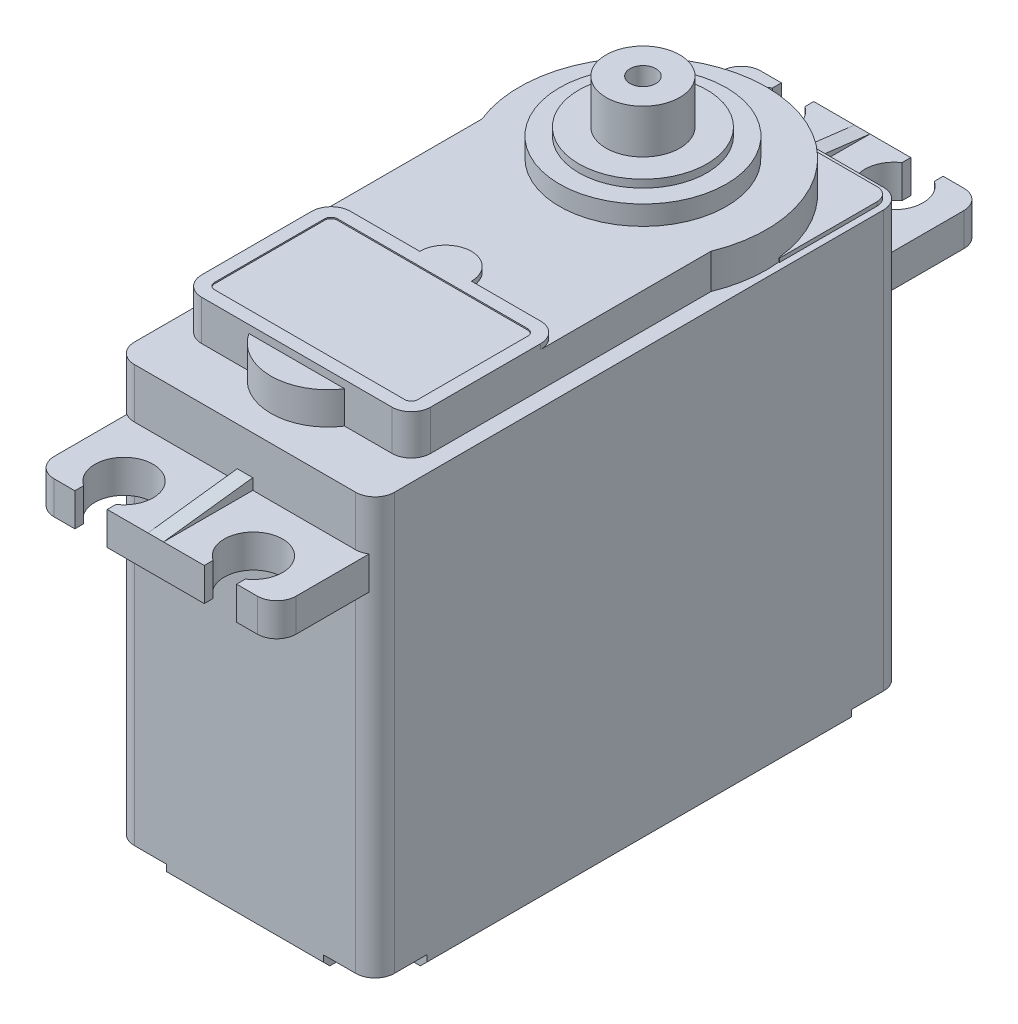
SolidWorks part; units mm, degrees
ref_plane "Front Plane" through (0, 0, 0) normal (0, 0, 1) x (1, 0, 0)
ref_plane "Top Plane" through (0, 0, 0) normal (0, 1, 0) x (1, 0, 0)
ref_plane "Right Plane" through (0, 0, 0) normal (1, 0, 0) x (0, 0, -1)
sketch "Sketch1" plane through (0, 0, 0) normal (0, 1, 0) x (1, 0, 0)
  line L0 (-10.05, -5.18) -> (10.05, -5.18) construction
  line L1 (-8.55, -25.58) -> (8.55, -25.58)
  line L2 (-10.05, -24.08) -> (-10.05, 13.72)
  line L3 (-8.55, 15.22) -> (8.55, 15.22)
  line L4 (10.05, -24.08) -> (10.05, 13.72)
  line L5 (-10.05, -25.58) -> (10.05, 15.22) construction
  line L6 (-10.05, 15.22) -> (10.05, -25.58) construction
  line L7 (0, -5.18) -> (0, 15.22) construction
  arc A0 (-10.05, 13.72) -> (-8.55, 15.22) centre (-8.55, 13.72) cw
  arc A1 (8.55, 15.22) -> (10.05, 13.72) centre (8.55, 13.72) cw
  arc A2 (10.05, -24.08) -> (8.55, -25.58) centre (8.55, -24.08) cw
  arc A3 (-8.55, -25.58) -> (-10.05, -24.08) centre (-8.55, -24.08) cw
  point P0 (0, 0)
  dimension "D5" = 1.5
  dimension "D1" = 20.1
  dimension "D2" = 40.8
  dimension "D3" = 25.58
extrude "Boss-Extrude1" add sketch "Sketch1" along normal blind 33.2
ref_plane "Plane1" through (0, 26.8, 0) normal (0, 1, 0) x (1, 0, 0)
sketch "Sketch4" plane through (0, 26.8, 0) normal (0, 1, 0) x (1, 0, 0)
  line L0 (-6.25, 22.12) -> (-6.25, 21.4408)
  line L1 (-7.85, -32.48) -> (-6.25, -32.48)
  line L2 (-9.35, -30.98) -> (-9.35, 20.62)
  line L3 (-7.85, 22.12) -> (-6.25, 22.12)
  line L4 (9.35, -30.98) -> (9.35, 20.62)
  line L5 (-9.35, -32.48) -> (9.35, 22.12) construction
  line L6 (-9.35, 22.12) -> (9.35, -32.48) construction
  line L7 (-3.75, 22.12) -> (-3.75, 21.4408)
  line L8 (-3.75, 22.12) -> (3.75, 22.12)
  line L9 (-10.05, -5.18) -> (10.05, -5.18) construction
  line L10 (6.25, 22.12) -> (7.85, 22.12)
  line L11 (6.25, -32.48) -> (6.25, -31.8008)
  line L12 (3.75, -32.48) -> (3.75, -31.8008)
  line L13 (0, -25.58) -> (0, 15.22) construction
  line L14 (-8.55, -25.58) -> (8.55, -25.58) construction
  line L15 (8.55, 15.22) -> (-8.55, 15.22) construction
  line L16 (-3.75, -32.48) -> (3.75, -32.48)
  line L17 (3.75, 22.12) -> (3.75, 21.4408)
  line L18 (6.25, 22.12) -> (6.25, 21.4408)
  line L19 (-3.75, -32.48) -> (-3.75, -31.8008)
  line L20 (-6.25, -32.48) -> (-6.25, -31.8008)
  line L21 (6.25, -32.48) -> (7.85, -32.48)
  line L22 (-10.05, 13.72) -> (-10.05, -24.08) construction
  arc A0 (7.85, 22.12) -> (9.35, 20.62) centre (7.85, 20.62) cw
  arc A1 (9.35, -30.98) -> (7.85, -32.48) centre (7.85, -30.98) cw
  arc A2 (-7.85, -32.48) -> (-9.35, -30.98) centre (-7.85, -30.98) cw
  arc A3 (-9.35, 20.62) -> (-7.85, 22.12) centre (-7.85, 20.62) cw
  arc A4 (-6.25, 21.4408) -> (-3.75, 21.4408) centre (-5, 19.57) ccw
  arc A5 (6.25, -31.8008) -> (3.75, -31.8008) centre (5, -29.93) ccw
  arc A6 (6.25, 21.4408) -> (3.75, 21.4408) centre (5, 19.57) cw
  arc A7 (-6.25, -31.8008) -> (-3.75, -31.8008) centre (-5, -29.93) cw
  point P0 (0, -5.18)
  dimension "D3" = 1.5
  dimension "D4" = 2.5
  dimension "D5" = 2.25
  dimension "D1" = 18.7
  dimension "D6" = 0.6792
  dimension "D7" = 10
  dimension "D8" = 49.5
extrude "Boss-Extrude2" add sketch "Sketch4" along normal blind 2.55
sketch "Sketch16" plane through (0, 33.2, 0) normal (0, 1, 0) x (1, 0, 0)
  line L0 (-9.55, 6.17) -> (9.55, 6.17)
  line L1 (0, 14.72) -> (0, -2.38) construction
  line L8 (-9.55, 13.72) -> (-9.55, -24.08)
  line L9 (-8.55, -25.08) -> (8.55, -25.08)
  line L10 (9.55, -24.08) -> (9.55, 13.72)
  line L11 (8.55, 14.72) -> (-8.55, 14.72)
  line L12 (-9.55, 13.72) -> (-9.55, -24.08)
  line L13 (-8.55, -25.08) -> (8.55, -25.08)
  line L14 (9.55, -24.08) -> (9.55, 13.72)
  line L15 (8.55, 14.72) -> (-8.55, 14.72)
  arc A8 (-8.55, 14.72) -> (-9.55, 13.72) centre (-8.55, 13.72) ccw
  arc A9 (-9.55, -24.08) -> (-8.55, -25.08) centre (-8.55, -24.08) ccw
  arc A10 (8.55, -25.08) -> (9.55, -24.08) centre (8.55, -24.08) ccw
  arc A11 (9.55, 13.72) -> (8.55, 14.72) centre (8.55, 13.72) ccw
  arc A12 (-8.55, 14.72) -> (-9.55, 13.72) centre (-8.55, 13.72) ccw
  arc A13 (-9.55, -24.08) -> (-8.55, -25.08) centre (-8.55, -24.08) ccw
  arc A14 (8.55, -25.08) -> (9.55, -24.08) centre (8.55, -24.08) ccw
  arc A15 (9.55, 13.72) -> (8.55, 14.72) centre (8.55, 13.72) ccw
  point P4 (0, 6.17)
  dimension "D1" = 0.5
extrude "Boss-Extrude11" add sketch "Sketch16" along normal blind 0.3 contours L1 L15 A12 L12 L0 | L15 L1 L0 L14 A15
sketch "Sketch5" plane through (0, 33.2, 0) normal (0, 1, 0) x (1, 0, 0)
  line L0 (8.55, -25.58) -> (-8.55, -25.58) construction
  line L1 (9.55, 6.17) -> (9.55, 13.72) construction
  line L2 (-8.85, 1.5811) -> (-8.85, -20.08)
  line L3 (-7.35, -21.58) -> (7.35, -21.58)
  line L4 (8.85, 1.5811) -> (8.85, -20.08)
  line L5 (-9.55, 13.72) -> (-9.55, 6.17) construction
  line L6 (0, 5.17) -> (0, -21.58) construction
  line L7 (8.55, 14.72) -> (-8.55, 14.72) construction
  arc A0 (8.85, 1.5811) -> (-8.85, 1.5811) centre (0, 5.17) ccw
  arc A1 (8.85, -20.08) -> (7.35, -21.58) centre (7.35, -20.08) cw
  arc A2 (-7.35, -21.58) -> (-8.85, -20.08) centre (-7.35, -20.08) cw
  dimension "D2" = 1.5
  dimension "D3" = 17.7
  dimension "D6" = 4
extrude "Boss-Extrude3" add sketch "Sketch5" along normal blind 2.7
sketch "Sketch6" plane through (0, 33.2, 0) normal (0, 1, 0) x (1, 0, 0)
  circle A0 centre (0, -19.1575) radius 4.4225
extrude "Boss-Extrude4" add sketch "Sketch6" along normal blind 2.5
sketch "Sketch7" plane through (0, 35.9, 0) normal (0, 1, 0) x (1, 0, 0)
  circle A0 centre (0, 5.17) radius 6.45
  arc A1 (8.85, 1.5811) -> (-8.85, 1.5811) centre (0, 5.17) ccw construction
  dimension "D1" = 12.9
extrude "Boss-Extrude5" add sketch "Sketch7" along normal blind 1.5
sketch "Sketch8" plane through (0, 37.4, 0) normal (0, 1, 0) x (1, 0, 0)
  circle A2 centre (0, 5.17) radius 4.95
  circle A3 centre (0, 5.17) radius 4.95
  dimension "D1" = 1.5
extrude "Boss-Extrude6" add sketch "Sketch8" along normal blind 0.6
sketch "Sketch10" plane through (0, 38, 0) normal (0, 1, 0) x (1, 0, 0)
  circle A1 centre (0, 5.17) radius 2.85
  dimension "D1" = 5.7
extrude "Boss-Extrude7" add sketch "Sketch10" along normal blind 3.4
sketch "Sketch12" plane through (0, 41.4, 0) normal (0, 1, 0) x (1, 0, 0)
  circle A0 centre (0, 5.17) radius 1
  dimension "D1" = 2
extrude "Cut-Extrude1" cut sketch "Sketch12" against normal blind 5
sketch "Sketch13" plane through (0, 35.9, 0) normal (0, 1, 0) x (1, 0, 0)
  line L0 (-8.85, 1.5811) -> (-8.85, -20.08) construction
  line L1 (-7.35, -21.58) -> (7.35, -21.58) construction
  line L2 (8.85, -20.08) -> (8.85, 1.5811) construction
  line L3 (-8.85, -11.58) -> (-8.85, -20.08)
  line L4 (-7.35, -21.58) -> (7.35, -21.58)
  line L5 (8.85, -20.08) -> (8.85, -11.58)
  line L6 (-7.85, -11.58) -> (-7.85, -20.08)
  line L7 (-7.35, -20.58) -> (7.35, -20.58)
  line L8 (7.85, -20.08) -> (7.85, -11.58)
  line L9 (-7.35, -11.08) -> (7.35, -11.08)
  line L10 (-7.35, -10.08) -> (-2, -10.08)
  line L11 (2, -10.08) -> (7.35, -10.08)
  line L12 (0, -10.08) -> (0, -11.08) construction
  arc A0 (-8.85, -20.08) -> (-7.35, -21.58) centre (-7.35, -20.08) ccw construction
  arc A1 (7.35, -21.58) -> (8.85, -20.08) centre (7.35, -20.08) ccw construction
  arc A2 (-8.85, -20.08) -> (-7.35, -21.58) centre (-7.35, -20.08) ccw
  arc A3 (7.35, -21.58) -> (8.85, -20.08) centre (7.35, -20.08) ccw
  arc A4 (-7.85, -20.08) -> (-7.35, -20.58) centre (-7.35, -20.08) ccw
  arc A5 (7.35, -20.58) -> (7.85, -20.08) centre (7.35, -20.08) ccw
  arc A6 (7.35, -11.08) -> (7.85, -11.58) centre (7.35, -11.58) cw
  arc A7 (-7.35, -11.08) -> (-7.85, -11.58) centre (-7.35, -11.58) ccw
  arc A8 (7.35, -10.08) -> (8.85, -11.58) centre (7.35, -11.58) cw
  arc A9 (-7.35, -10.08) -> (-8.85, -11.58) centre (-7.35, -11.58) ccw
  arc A10 (2, -10.08) -> (-2, -10.08) centre (0, -10.08) ccw
  point P8 (-7.85, 0.3518)
  point P15 (7.85, 0.3518)
  point P27 (0, 0)
  point P30 (-0.1288, -9.0569)
  point P32 (-7.786, -11.601)
  dimension "D2" = 0.5
  dimension "D1" = 1
  dimension "D3" = 1.5
  dimension "D4" = 4
  dimension "D5" = 9.5
extrude "Boss-Extrude9" add sketch "Sketch13" along normal blind 0.4
sketch "Sketch14" plane through (0, 35.9, 0) normal (0, 1, 0) x (1, 0, 0)
  line L3 (-7.85, -11.58) -> (-7.85, -20.08)
  line L4 (-7.85, -11.58) -> (-7.85, -20.08)
  line L5 (-7.35, -20.58) -> (7.35, -20.58)
  line L6 (-7.35, -20.58) -> (7.35, -20.58)
  line L7 (7.85, -20.08) -> (7.85, -11.58)
  line L8 (7.85, -20.08) -> (7.85, -11.58)
  line L10 (7.35, -11.08) -> (-7.35, -11.08)
  line L11 (7.35, -11.08) -> (-7.35, -11.08)
  arc A3 (-7.85, -20.08) -> (-7.35, -20.58) centre (-7.35, -20.08) ccw
  arc A4 (-7.85, -20.08) -> (-7.35, -20.58) centre (-7.35, -20.08) ccw
  arc A5 (7.35, -20.58) -> (7.85, -20.08) centre (7.35, -20.08) ccw
  arc A6 (7.35, -20.58) -> (7.85, -20.08) centre (7.35, -20.08) ccw
  arc A7 (7.85, -11.58) -> (7.35, -11.08) centre (7.35, -11.58) ccw
  arc A8 (7.85, -11.58) -> (7.35, -11.08) centre (7.35, -11.58) ccw
  arc A10 (-7.35, -11.08) -> (-7.85, -11.58) centre (-7.35, -11.58) ccw
  arc A11 (-7.35, -11.08) -> (-7.85, -11.58) centre (-7.35, -11.58) ccw
  dimension "D1" = 0
extrude "Boss-Extrude10" add sketch "Sketch14" along normal blind 0.3
chamfer "Chamfer1" distance 0.5 angle 45 8 edges at (-10.05, 0, 5.18) (-9.6107, 0, 25.1407) (0, 0, 25.58) (9.6107, 0, 25.1407) (10.05, 0, 5.18) (9.6107, 0, -14.7807) (0, 0, -15.22) (-9.6107, 0, -14.7807)
sketch "Sketch17" plane through (0, 0, 0) normal (0, -1, 0) x (1, 0, 0)
  line L0 (-10.05, -13.72) -> (-10.05, 24.08) construction
  line L1 (-8.55, 25.58) -> (8.55, 25.58) construction
  line L3 (-10.05, 21.58) -> (-10.05, 24.08)
  line L4 (-8.55, 25.58) -> (-6.05, 25.58)
  line L5 (-6.05, 25.58) -> (-6.05, 23.08)
  line L6 (-7.55, 21.58) -> (-10.05, 21.58)
  arc A0 (-8.55, 25.58) -> (-10.05, 24.08) centre (-8.55, 24.08) ccw construction
  arc A3 (-8.55, 25.58) -> (-10.05, 24.08) centre (-8.55, 24.08) ccw
  arc A4 (-6.05, 23.08) -> (-7.55, 21.58) centre (-7.55, 23.08) cw
  point P10 (-6.05, 21.58)
  dimension "D3" = 1.5
  dimension "D1" = 4
  dimension "D2" = 4
extrude "Cut-Extrude2" cut sketch "Sketch17" against normal blind 1
mirror "Mirror1" about plane through (0, 0, 0) normal (1, 0, 0) of "Cut-Extrude2"
ref_plane "Plane2" through (0, 0, 5.18) normal (0, 0, 1) x (1, 0, 0)
mirror "Mirror2" about plane through (0, 0, 5.18) normal (0, 0, 1) of "Mirror1", "Cut-Extrude2"
sketch "Sketch19" plane through (0, 0, 0) normal (1, 0, 0) x (0, 0, -1)
  line L0 (-25.58, 30.2) -> (-25.58, 29.35)
  line L1 (-25.58, 33.2) -> (-25.58, 29.35) construction
  line L2 (-25.58, 29.35) -> (-32.48, 29.35)
  line L3 (-32.48, 29.35) -> (-25.58, 30.2)
  line L4 (15.22, 30.2) -> (15.22, 29.35)
  line L5 (15.22, 33.2) -> (15.22, 29.35) construction
  line L6 (14.9889, 29.35) -> (20.62, 29.35) construction
  line L7 (15.22, 29.35) -> (22.12, 29.35)
  line L8 (22.12, 29.35) -> (15.22, 30.2)
  dimension "D1" = 0.85
extrude "Boss-Extrude12" add sketch "Sketch19" along normal mid plane 1.2
